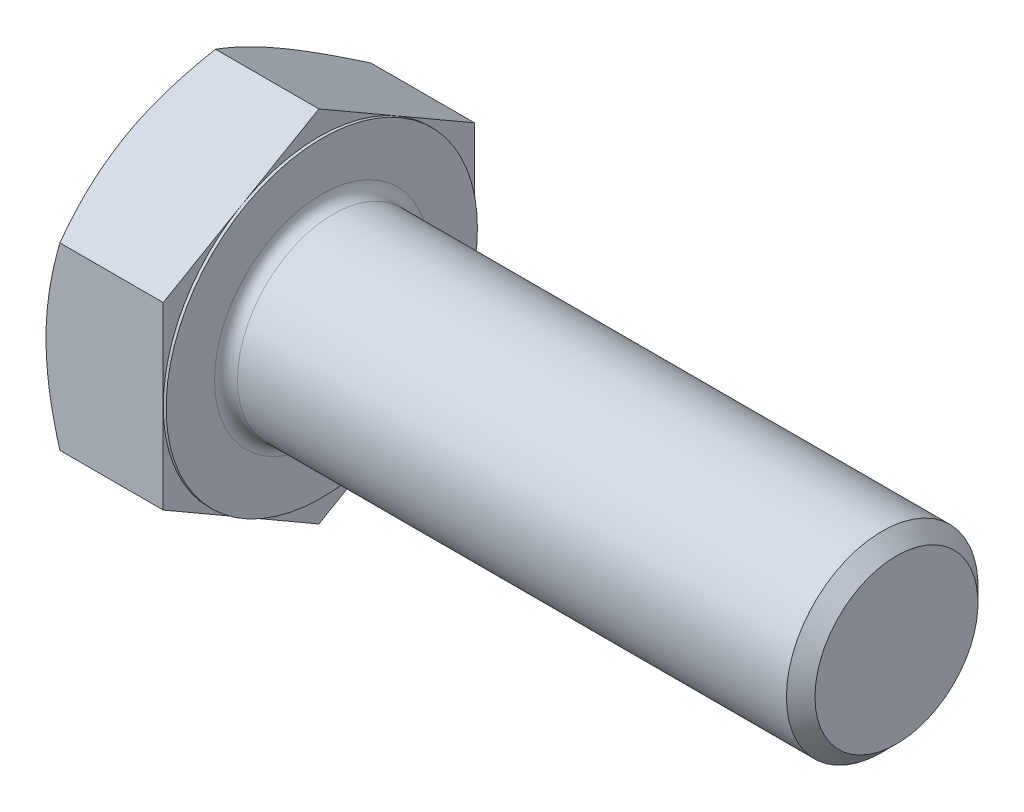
SolidWorks part; units mm, degrees
extrude "BaseHead" add sketch "Sketch1" along normal blind 15.9258
sketch "Sketch1" plane through (0, 0, 0) normal (1, 0, 0) x (0, 0, -1)
  line L0 (20.6375, 11.9151) -> (20.6375, -11.9151)
  line L1 (-20.6375, 11.9151) -> (-20.6375, -11.9151)
  line L2 (20.6375, -11.9151) -> (0, -23.8301)
  line L3 (0, -23.8301) -> (-20.6375, -11.9151)
  line L4 (20.6375, 11.9151) -> (0, 23.8301)
  line L5 (0, 23.8301) -> (-20.6375, 11.9151)
revolve "HeadChamfer" cut sketch "Sketch3" angle 360 about L6
sketch "Sketch3" plane through (0, 0, 0) normal (0, 0, 1) x (1, 0, 0)
  line L0 (0, 20.6375) -> (5.5094, 30.1801)
  line L1 (0, 23.8301) -> (0, 11.9151) construction
  line L2 (5.5094, 30.1801) -> (5.5094, 36.5301)
  line L3 (5.5094, 36.5301) -> (-12.7, 36.5301)
  line L4 (-12.7, 36.5301) -> (-12.7, 20.6375)
  line L5 (-12.7, 20.6375) -> (0, 20.6375)
  line L6 (0, 0) -> (99.06, 0) construction
  line L7 (15.9258, 23.8301) -> (0, 23.8301) construction
ref_plane "Plane1" through (0, 0, 0) normal (0, 0, 1) x (1, 0, 0)
ref_plane "Plane2" through (0, 0, 0) normal (0, 1, 0) x (1, 0, 0)
ref_plane "Plane3" through (0, 0, 0) normal (1, 0, 0) x (0, 0, -1)
sketch "BodySke" plane through (0, 0, 0) normal (0, 0, 1) x (1, 0, 0)
  line L0 (0, 11.9151) -> (0, -11.9151) construction
  line L1 (0, 0) -> (92.1258, 0)
  line L2 (0, 0) -> (0, 12.7)
  line L3 (0, 12.7) -> (90.2335, 12.7)
  line L4 (92.1258, 0) -> (92.1258, 10.8077)
  line L5 (15.9258, 23.8301) -> (15.9258, 11.9151) construction
  line L6 (92.1258, 10.8077) -> (90.2335, 12.7)
  line L7 (0, 0) -> (96.52, 0) construction
  line L8 (92.1258, -10.8077) -> (90.2335, -12.7) construction
  line L9 (0, -12.7) -> (90.2335, -12.7) construction
  line L10 (18.034, 15.24) -> (18.034, -1.27) construction
  line L11 (60.3758, 15.24) -> (60.3758, -1.27) construction
  line L12 (15.9258, 11.9151) -> (15.9258, -11.9151) construction
revolve "BaseBody" add sketch "BodySke" angle 360 about L7
sketch "Sketch4" plane through (0, 0, 0) normal (0, 0, 1) x (1, 0, 0)
  line L1 (15.9258, 23.8301) -> (15.9258, 11.9151) construction
  line L2 (15.9258, 20.6375) -> (15.5448, 20.6375)
  line L3 (15.9258, 20.6375) -> (15.9258, 49.2301)
  line L4 (15.9258, 49.2301) -> (15.5448, 49.2301)
  line L5 (0, 0) -> (95.25, 0) construction
  line L6 (0, 0) -> (96.52, 0) construction
  line L7 (15.5448, 20.6375) -> (15.5448, 49.2301)
  line L8 (15.9258, 23.8301) -> (1.8433, 23.8301) construction
revolve "BearingFace" cut sketch "Sketch4" angle 360 about L5
fillet "HeadFillet" radius 1.524 1 edges at (15.9258, 0, -12.7)
sketch "ThdSchSke" plane through (0, 0, 0) normal (0, 0, 1) x (1, 0, 0)
  line L0 (60.3758, -10.8077) -> (59.0508, -12.7)
  line L1 (60.3758, -10.8077) -> (61.7008, -12.7)
  line L2 (61.7008, -12.7) -> (61.7008, -15.875)
  line L3 (-3.175, 0) -> (5.1513, 0) construction
  line L5 (61.7008, -15.875) -> (59.0508, -15.875)
  line L6 (59.0508, -15.875) -> (59.0508, -12.7)
revolve "ThreadSchematic" [suppressed] cut sketch "ThdSchSke" angle 360 about L3
pattern_linear "ThdSchPat" [suppressed]
equation "\"D3@Sketch1\" = \"Width_flats@Sketch1\" / 2"
equation "\"D4@Sketch1\" = \"D3@Sketch1\""
equation "\"D5@Sketch1\" = \"D4@Sketch1\""
equation "\"Thread_minor@ThreadCosmetic\" = \"Minor_dia@BodySke\""
equation "\"D1@Sketch3\" = \"Width_flats@Sketch1\" / 2"
equation "\"D1@Sketch4\" = \"Width_flats@Sketch1\" / 2"
equation "\"Thread_length@ThreadCosmetic\" = ((sgn( (\"Length@BodySke\" - \"Advance@BodySke\" ) - \"Thread_nom@BodySke\" )-1)*( (\"Length@BodySke\" - \"Advance@BodySke\" ) - \"Thread_nom@BodySke\" ))/-2+ \"Thread_nom@BodySke\""
equation "\"Thread_minor@ThdSchSke\" = \"Minor_dia@BodySke\""
equation "\"Diameter@ThdSchSke\" = \"Diameter@BodySke\""
equation "\"Overcut@ThdSchSke\" = \"Diameter@BodySke\" * 1.25"
equation "\"Start@ThdSchSke\" = \"Head_ht@BaseHead\" + \"Length@BodySke\" - \"Thread_length@ThreadCosmetic\"  '---Non-countersunk---"
equation "\"Num_threads@ThdSchPat\" = int( \"Thread_length@ThreadCosmetic\" / \"Advance@BodySke\" + 0.999 )  + 1"
equation "\"Advance@ThdSchPat\" = \"Thread_length@ThreadCosmetic\" /  (\"Num_threads@ThdSchPat\" - 1) 'relax it"
equation "\"Num_threads@ThdSchPat\" = \"Num_threads@ThdSchPat\" - sgn( \"Num_threads@ThdSchPat\" - 1) '---chamfered tips only---"
